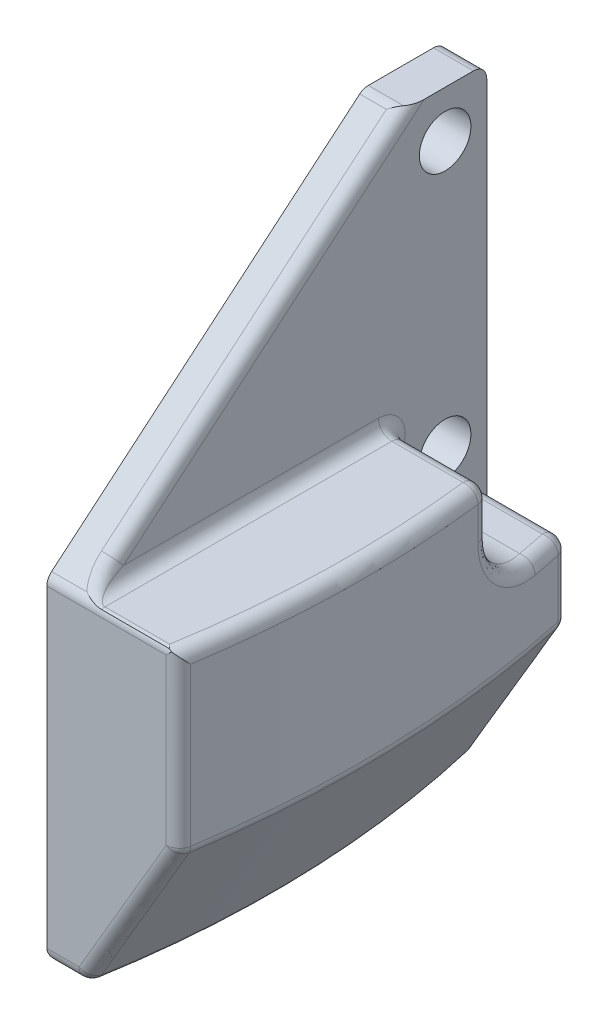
SolidWorks part; units mm, degrees
other "<elexModuleHousingGuide>-<Fillet1>"
ref_plane "Front Plane" through (0, 0, 0) normal (0, 0, 1) x (1, 0, 0)
ref_plane "Top Plane" through (0, 0, 0) normal (0, 1, 0) x (1, 0, 0)
ref_plane "Right Plane" through (0, 0, 0) normal (1, 0, 0) x (0, 0, -1)
ref_plane "Front Plane-elexModuleHousingGuide_Mirrored" through (0, 0, 0) normal (0, 0, -1) x (1, 0, 0)
ref_plane "Top Plane-elexModuleHousingGuide_Mirrored" through (0, 0, 0) normal (0, 1, 0) x (1, 0, 0)
ref_plane "Right Plane-elexModuleHousingGuide_Mirrored" through (0, 0, 0) normal (1, 0, 0) x (0, 0, 1)
ref_plane "Plane1-elexModuleHousingGuide_Mirrored" through (85.2487, 0, 0) normal (1, 0, 0) x (0, 0, 1)
ref_plane "Plane2-elexModuleHousingGuide_Mirrored" through (99.06, 0, 0) normal (1, 0, 0) x (0, 0, 1)
ref_plane "Plane3-elexModuleHousingGuide_Mirrored" through (0, 52.705, 0) normal (0, 1, 0) x (1, 0, 0)
mirrored part "elexModuleHousingGuide_Mirrored" parameters "D1.Boss-Extrude1"=3.81, "D1.Sketch4"=7.9375, "D2.Sketch4"=57.15, "D3.Sketch4"=31.75, "D4.Sketch4"=38.1, "D1.Sketch5"=19.05, "D1.Cut-Revolve1"=360, "D2.Sketch6"=1.27, "D3.Sketch6"=60, "D4.Sketch6"=12.7, "D1.Sketch6"=198.12, "Thru Hole Dia..Sketch9"=4.9149, "Thru Hole Depth.Sketch9"=13.8113, "D1.Sketch11"=10.16, "D1.Fillet1"=1.27, "D1.Sketch10"=25.4, "D2.Sketch10"=4.445, "D3.Sketch10"=3.9688
